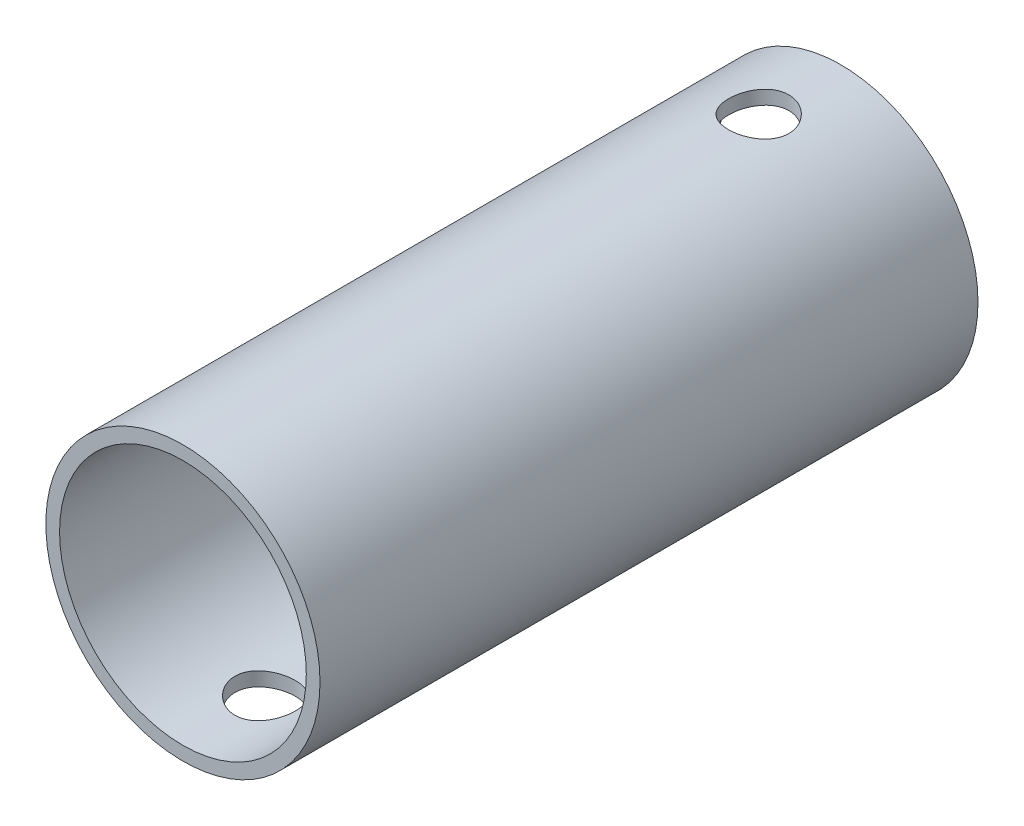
SolidWorks part; units mm, degrees
ref_plane "Front Plane" through (0, 0, 0) normal (0, 0, 1) x (1, 0, 0)
ref_plane "Top Plane" through (0, 0, 0) normal (0, 1, 0) x (1, 0, 0)
ref_plane "Right Plane" through (0, 0, 0) normal (1, 0, 0) x (0, 0, -1)
sketch "Sketch1" plane through (0, 0, 0) normal (0, 0, 1) x (1, 0, 0)
  circle A0 centre (0, 0) radius 250
  circle A1 centre (0, 0) radius 225
  dimension "D1" = 500
  dimension "D2" = 450
extrude "Boss-Extrude1" add sketch "Sketch1" along normal blind 1200
sketch "Sketch4" plane through (0, 0, 0) normal (0, 1, 0) x (1, 0, 0)
  line L0 (250, 0) -> (-250, 0) construction
  circle A0 centre (0, -150) radius 55
  dimension "D1" = 110
  dimension "D2" = 150
extrude "Cut-Extrude1" cut sketch "Sketch4" along normal blind 1200
sketch "Sketch5" plane through (0, 0, 0) normal (0, 1, 0) x (1, 0, 0)
  line L0 (-250, -1200) -> (250, -1200) construction
  circle A0 centre (0, -1050) radius 55
  dimension "D2" = 110
  dimension "D1" = 150
extrude "Cut-Extrude2" cut sketch "Sketch5" against normal blind 1200
